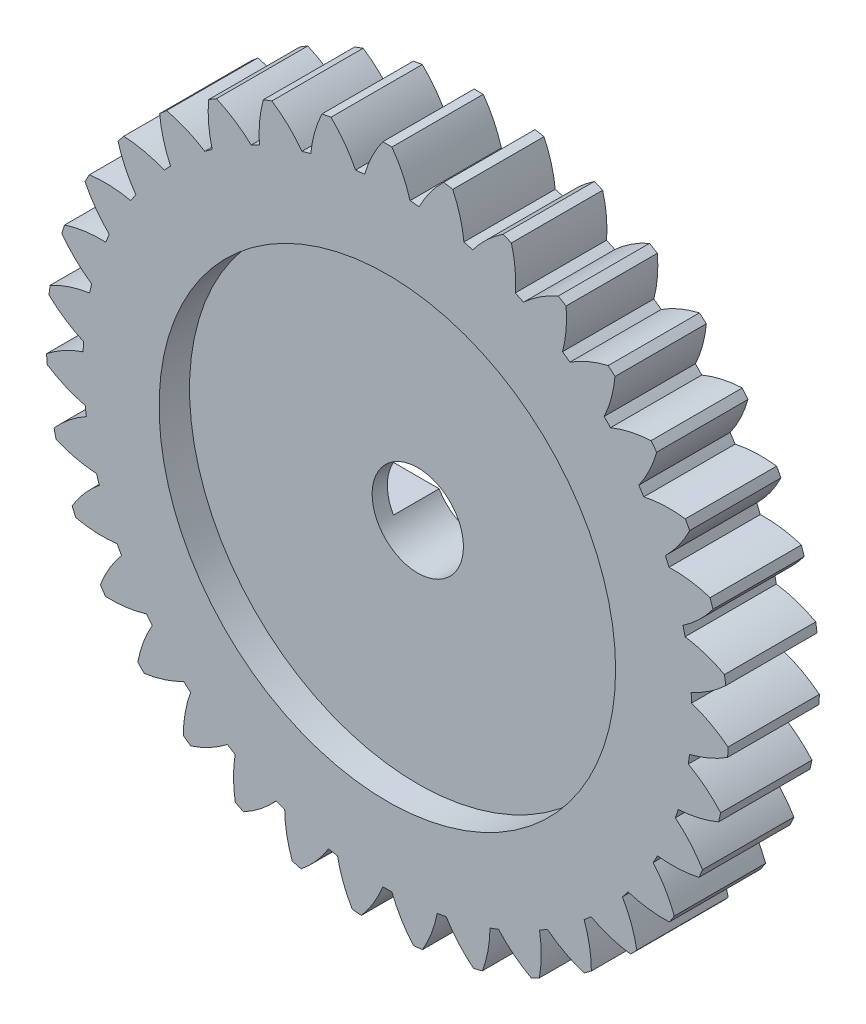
SolidWorks part; units mm, degrees
ref_plane "Plan1" through (0, 0, 0) normal (0, 0, 1) x (1, 0, 0)
ref_plane "Plan2" through (0, 0, 0) normal (0, 1, 0) x (1, 0, 0)
ref_plane "Plan3" through (0, 0, 0) normal (1, 0, 0) x (0, 0, -1)
sketch "Esquisse1" plane through (0, 0, 0) normal (0, 0, 1) x (1, 0, 0)
  circle A0 centre (0, 0) radius 11.2
  dimension "D1" = 22.4
extrude "Base-Extrusion" add sketch "Esquisse1" along normal blind 3
sketch "Esquisse4" plane through (0, 0, 3) normal (0, 0, 1) x (1, 0, 0)
  line L0 (0, 0) -> (0, 13.9994) construction
  line L1 (0, 0) -> (1.2834, 14.2596) construction
  line L2 (0, 0) -> (2.6362, 14.5269) construction
  line L3 (0.8964, 9.9597) -> (1.2381, 13.7563)
  line L4 (-0.8964, 9.9597) -> (-1.2381, 13.7563)
  line L5 (1.2381, 13.7563) -> (-1.2381, 13.7563)
  circle A0 centre (0, 0) radius 11.2 construction
  circle A1 centre (0, 0) radius 10 construction
  arc A2 (-0.7469, 9.9721) -> (-0.8964, 9.9597) centre (0, 0) ccw
  arc A3 (-0.15, 11.199) -> (0.15, 11.199) centre (0, 0) cw
  arc A4 (0.15, 11.199) -> (0.7469, 9.9721) centre (-3.0958, 8.8613) cw
  arc A7 (-0.15, 11.199) -> (-0.7469, 9.9721) centre (3.0958, 8.8613) ccw
  arc A8 (0.7469, 9.9721) -> (0.8964, 9.9597) centre (0, 0) cw
  dimension "D1" = 20
  dimension "D2" = 22.4
  dimension "D7" = 4
  dimension "D3" = 5.143
  dimension "D4" = 10.286
  dimension "D5" = 0.15
  dimension "D6" = 0.15
extrude "Enlèv. mat.-Extru.2" cut sketch "Esquisse4" against normal through all
pattern_circular "Répétition circulaire2" count 35 over 360 about axis through (0, 0, 0) along (0, 0, 1) of "Enlèv. mat.-Extru.2"
sketch "Esquisse5" plane through (0, 0, 3) normal (0, 0, 1) x (1, 0, 0)
  circle A0 centre (0, 0) radius 7.5
  dimension "D1" = 15
extrude "Enlèv. mat.-Extru.3" cut sketch "Esquisse5" against normal blind 1
sketch "Esquisse6" plane through (0, 0, 0) normal (0, 0, -1) x (-1, 0, 0)
  line L0 (-10.0339, 0) -> (12.0946, 0) construction
  line L1 (0, 9.8941) -> (0, -9.8941) construction
  line L2 (1.299, 0.75) -> (5, 0.75)
  line L3 (-5, 0.75) -> (-1.299, 0.75)
  line L4 (-5, 0.75) -> (-5, -0.75)
  line L5 (-5, -0.75) -> (-1.299, -0.75)
  line L6 (5, 0.75) -> (5, -0.75)
  line L7 (1.299, -0.75) -> (5, -0.75)
  arc A0 (1.299, 0.75) -> (-1.299, 0.75) centre (0, 0) ccw
  arc A1 (-1.299, -0.75) -> (1.299, -0.75) centre (0, 0) ccw
  dimension "D5" = 3
  dimension "D1" = 1.5
  dimension "D2" = 0.75
  dimension "D3" = 10
  dimension "D4" = 5
extrude "Enlèv. mat.-Extru.4" cut sketch "Esquisse6" against normal blind 1.5
sketch "Esquisse7" plane through (0, 0, 1.5) normal (0, 0, -1) x (-1, 0, 0)
  circle A0 centre (0, 0) radius 1.5
  dimension "D1" = 3
extrude "Enlèv. mat.-Extru.5" cut sketch "Esquisse7" against normal through all
